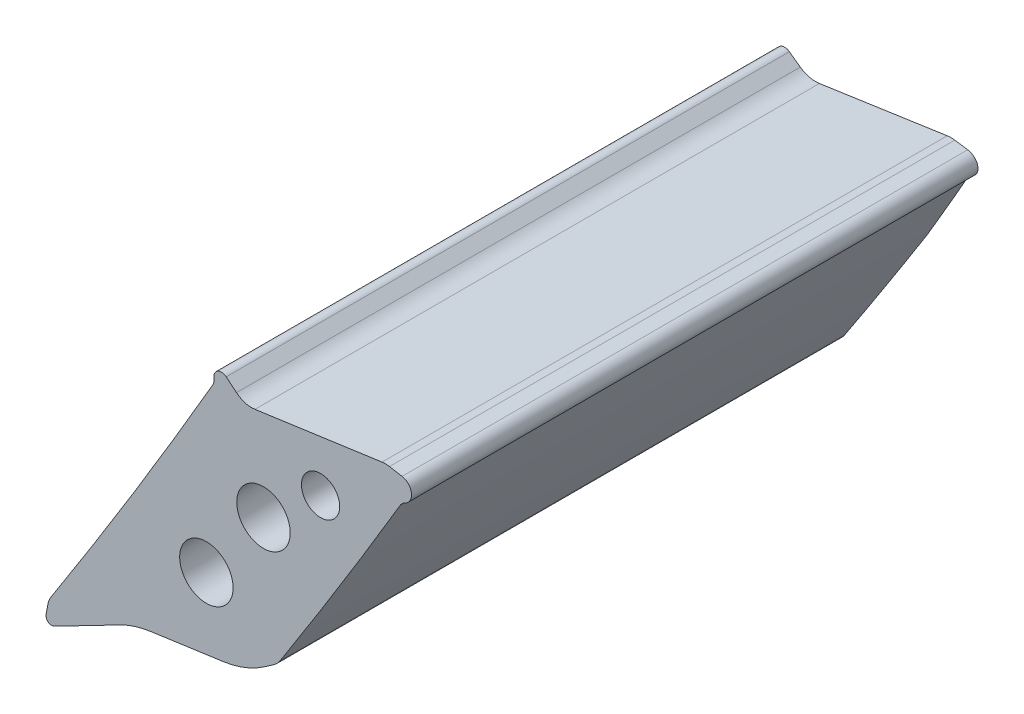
SolidWorks part; units mm, degrees
other "<QU250515L_Punch1[Mounted in the strip]>-<Punch Extrude>"
ref_plane "Front" through (0, 0, 0) normal (0, 0, 1) x (1, 0, 0)
ref_plane "Top" through (0, 0, 0) normal (0, 1, 0) x (1, 0, 0)
ref_plane "Right" through (0, 0, 0) normal (1, 0, 0) x (0, 0, -1)
inserted part "24051_Punch1[Mounted in the strip]1"
hole_wizard "Hole1" positions "Point_Sketch" profile "Profil_Sketch" legacy
sketch "Point_Sketch" plane through (-768.1381, 53.005, 71.9582) normal (0, 0, -1) x (1, 0, 0)
  point P0 (12.8691, 0.935)
sketch "Profil_Sketch" plane through (-755.269, 52.07, 71.9582) normal (1, 0, 0) x (0, -1, 0)
  line L0 (0, 0) -> (0, 76.9249)
  line L1 (0, 76.9249) -> (1.2065, 76.2)
  line L2 (1.2065, 76.2) -> (1.2065, 41.275)
  line L3 (1.2065, 41.275) -> (2.5527, 41.275)
  line L4 (2.5527, 0) -> (0, 0)
  line L5 (0, -11.3109) -> (0, 121.1557) construction
  line L6 (0, 76.9249) -> (-1.2065, 76.2) construction
  line L7 (2.5527, 41.275) -> (2.5527, 0)
  dimension "Depth" = 76.2
  dimension "Drill Angle" = 118
  dimension "Diameter" = 2.413
  dimension "L1" = 41.275
other "usin_TR460<1>"
hole_wizard "Hole11" positions "Point_Sketch1" profile "Profil_Sketch1" counterbore size "1/4" standard "ANSI Inch"
sketch "Point_Sketch1" plane through (-750.0199, 46.655, -4.2418) normal (0, 0, 1) x (-1, 0, 0)
  point P0 (12.8691, 0.935)
  point P2 (20.4891, 11.095)
sketch "Profil_Sketch1" plane through (-762.889, 45.72, -4.2418) normal (1, 0, 0) x (0, 1, 0)
  line L0 (0, 0) -> (0, 76.2)
  line L1 (0, 76.2) -> (3.5687, 76.2)
  line L3 (3.5687, 76.2) -> (3.5687, 22.352)
  line L4 (3.5687, 22.352) -> (5.3594, 22.352)
  line L5 (5.3594, 22.352) -> (5.3594, 0)
  line L7 (5.3594, 0) -> (0, 0)
  line L11 (0, -6.35) -> (0, 107.95) construction
  dimension "Diameter" = 7.1374
  dimension "Thru Hole Depth" = 76.2
  dimension "L1" = 22.352
other "usin_LS160_.25-20x3-SHCS<1>"
sketch "Sketch1" plane through (0, 0, -4.2418) normal (0, 0, -1) x (-1, 0, 0)
  line L0 (790.8032, 19.2003) -> (761.4968, 29.4112)
  line L1 (762.7475, 28.5403) -> (761.4968, 29.4112) construction
  line L2 (747.0676, 60.0401) -> (764.0239, 57.6571) construction
  line L3 (747.0676, 60.0401) -> (764.0239, 57.6571)
  line L5 (750.3545, 46.7479) -> (780.5007, 39.4522) construction
  arc A3 (744.6362, 56.2588) -> (760.6739, 30.2655) centre (1472.8145, 487.596) ccw construction
  arc A4 (769.6824, 57.6234) -> (791.2342, 22.3726) centre (1512.5655, 487.596) ccw construction
  point P17 (765.4276, 43.1)
ref_plane "Plane1" through (-765.4276, 43.1, -4.2418) normal (-0.9719, -0.2352, 0) x (0, 0, 1)
sketch "Sketch2" plane through (-765.4276, 43.1, -4.2418) normal (-0.9719, -0.2352, 0) x (0, 0, 1)
  line L0 (0, 16.9077) -> (76.2, 16.9077)
  line L1 (0, 16.9077) -> (76.2, 16.9077) construction
  line L2 (76.2, 16.9077) -> (76.2, 16.5055)
  line L3 (76.2, 16.9077) -> (76.2, 16.5055) construction
  line L4 (76.2, 16.5055) -> (76.2, 15.0802)
  line L5 (76.2, 16.5055) -> (76.2, 15.0802) construction
  line L6 (76.2, 15.0802) -> (76.2, 13.8184)
  line L7 (76.2, 15.0802) -> (76.2, 13.8184) construction
  line L8 (76.2, 13.8184) -> (76.2, 12.1461)
  line L9 (76.2, 13.8184) -> (76.2, 12.1461) construction
  line L10 (76.2, 12.1461) -> (76.2, 11.8957)
  line L11 (76.2, 12.1461) -> (76.2, 11.8957) construction
  line L12 (76.2, 11.8957) -> (76.2, 11.2107)
  line L13 (76.2, 11.8957) -> (76.2, 11.2107) construction
  line L14 (76.2, 11.2107) -> (76.2, 8.3249)
  line L15 (76.2, 11.2107) -> (76.2, 8.3249) construction
  line L16 (76.2, 8.3249) -> (76.2, 7.899)
  line L17 (76.2, 8.3249) -> (76.2, 7.899) construction
  line L18 (76.2, 7.899) -> (76.2, -13.5926)
  line L19 (76.2, 7.899) -> (76.2, -13.5926) construction
  line L20 (76.2, -13.5926) -> (76.2, -14.2294)
  line L21 (76.2, -13.5926) -> (76.2, -14.2294) construction
  line L22 (76.2, -14.2294) -> (76.2, -14.7816)
  line L23 (76.2, -14.2294) -> (76.2, -14.7816) construction
  line L24 (76.2, -14.7816) -> (76.2, -15.6445)
  line L25 (76.2, -14.7816) -> (76.2, -15.6445) construction
  line L26 (76.2, -15.6445) -> (76.2, -17.2603)
  line L27 (76.2, -15.6445) -> (76.2, -17.2603) construction
  line L28 (76.2, -17.2603) -> (76.2, -17.282)
  line L29 (76.2, -17.2603) -> (76.2, -17.282) construction
  line L30 (76.2, -17.282) -> (0, -17.282)
  line L31 (76.2, -17.282) -> (0, -17.282) construction
  line L32 (0, -17.282) -> (0, -17.2603)
  line L33 (0, -17.282) -> (0, -17.2603) construction
  line L34 (0, -17.2603) -> (0, -15.6445)
  line L35 (0, -17.2603) -> (0, -15.6445) construction
  line L36 (0, -15.6445) -> (0, -14.7816)
  line L37 (0, -15.6445) -> (0, -14.7816) construction
  line L38 (0, -14.7816) -> (0, -14.2294)
  line L39 (0, -14.7816) -> (0, -14.2294) construction
  line L40 (0, -14.2294) -> (0, -13.5926)
  line L41 (0, -14.2294) -> (0, -13.5926) construction
  line L42 (0, -13.5926) -> (0, 7.899)
  line L43 (0, -13.5926) -> (0, 7.899) construction
  line L44 (0, 7.899) -> (0, 8.3249)
  line L45 (0, 7.899) -> (0, 8.3249) construction
  line L46 (0, 8.3249) -> (0, 11.2107)
  line L47 (0, 8.3249) -> (0, 11.2107) construction
  line L48 (0, 11.2107) -> (0, 11.8957)
  line L49 (0, 11.2107) -> (0, 11.8957) construction
  line L50 (0, 11.8957) -> (0, 12.1461)
  line L51 (0, 11.8957) -> (0, 12.1461) construction
  line L52 (0, 12.1461) -> (0, 13.8184)
  line L53 (0, 12.1461) -> (0, 13.8184) construction
  line L54 (0, 13.8184) -> (0, 15.0802)
  line L55 (0, 13.8184) -> (0, 15.0802) construction
  line L56 (0, 15.0802) -> (0, 16.5055)
  line L57 (0, 15.0802) -> (0, 16.5055) construction
  line L58 (0, 16.5055) -> (0, 16.9077)
  line L59 (0, 16.5055) -> (0, 16.9077) construction
  line L60 (1.0668, 16.9077) -> (0.002, -0.1555)
  line L61 (0.002, -0.2188) -> (1.0668, -17.282)
  line L63 (0, -0.1872) -> (-9.7759, -0.1872) construction
  arc A0 (0.002, -0.2188) -> (0.002, -0.1555) centre (0.509, -0.1872) cw
  dimension "D2" = 0.508
  dimension "D1" = 1.0668
extrude "Cut-Extrude1" cut sketch "Sketch2" against normal through all and the other way through all flip side to cut
